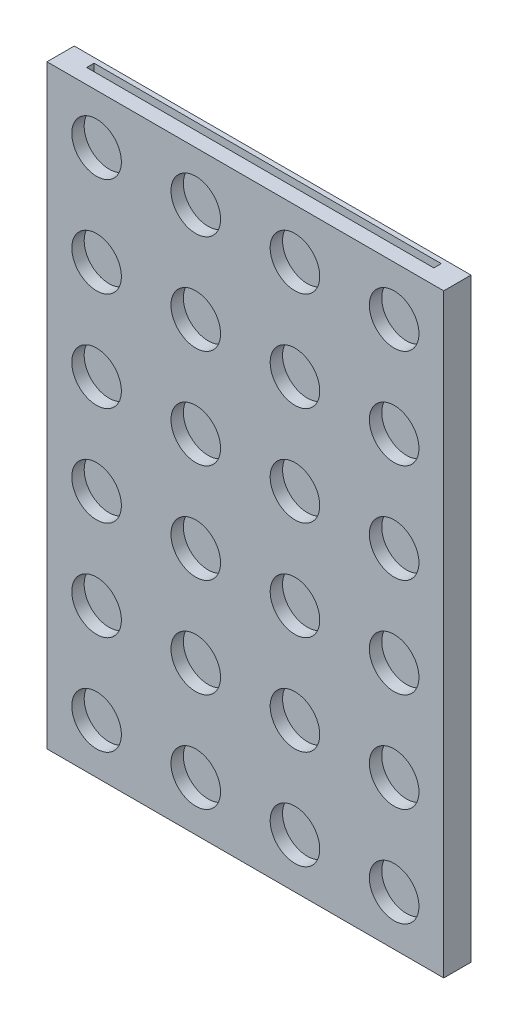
SolidWorks part; units mm, degrees
ref_plane "Front Plane" through (0, 0, 0) normal (0, 0, 1) x (1, 0, 0)
ref_plane "Top Plane" through (0, 0, 0) normal (0, 1, 0) x (1, 0, 0)
ref_plane "Right Plane" through (0, 0, 0) normal (1, 0, 0) x (0, 0, -1)
sketch "Sketch1" plane through (0, 0, 0) normal (0, 0, 1) x (1, 0, 0)
  line L1 (0, 0) -> (101.6, 0)
  line L2 (0, 0) -> (0, 152.4)
  line L3 (0, 152.4) -> (101.6, 152.4)
  line L4 (101.6, 0) -> (101.6, 152.4)
  dimension "D1" = 152.4
  dimension "D2" = 101.6
extrude "Boss-Extrude1" add sketch "Sketch1" along normal blind 6.985
sketch "Sketch3" plane through (0, 0, 6.985) normal (0, 0, 1) x (1, 0, 0)
  line L0 (0, 152.4) -> (0, 0) construction
  line L1 (101.6, 152.4) -> (0, 152.4) construction
  line L2 (0, 0) -> (101.6, 0) construction
  line L3 (25.4, 152.4) -> (25.4, 0)
  line L5 (12.7, 152.4) -> (12.7, 0)
  line L6 (38.1, 152.4) -> (38.1, 0)
  line L7 (50.8, 152.4) -> (50.8, 0)
  line L8 (63.5, 152.4) -> (63.5, 0)
  line L9 (76.2, 152.4) -> (76.2, 0)
  line L10 (88.9, 152.4) -> (88.9, 0)
  line L11 (0, 12.7) -> (101.6, 12.7)
  line L12 (101.6, 0) -> (101.6, 152.4) construction
  line L13 (0, 25.4) -> (101.6, 25.4)
  line L14 (0, 38.1) -> (101.6, 38.1)
  line L15 (0, 50.8) -> (101.6, 50.8)
  line L16 (0, 63.5) -> (101.6, 63.5)
  line L17 (0, 63.6141) -> (101.6, 63.6141)
  line L18 (0, 76.2) -> (101.6, 76.2)
  line L19 (0, 88.9) -> (101.6, 88.9)
  line L20 (0, 101.6) -> (101.6, 101.6)
  line L21 (0, 114.3) -> (101.6, 114.3)
  line L22 (0, 127) -> (101.6, 127)
  line L23 (0, 139.7) -> (101.6, 139.7)
  circle A0 centre (12.7, 139.7) radius 6.35
  circle A2 centre (38.1, 139.7) radius 6.35
  circle A4 centre (63.5, 139.7) radius 6.35
  circle A6 centre (88.9, 139.7) radius 6.35
  circle A7 centre (88.9, 114.3) radius 6.35
  circle A8 centre (63.5, 114.3) radius 6.35
  circle A9 centre (38.1, 114.3) radius 6.35
  circle A10 centre (12.7, 114.3) radius 6.35
  circle A11 centre (88.9, 88.9) radius 6.35
  circle A12 centre (63.5, 88.9) radius 6.35
  circle A13 centre (38.1, 88.9) radius 6.35
  circle A14 centre (12.7, 88.9) radius 6.35
  circle A15 centre (88.9, 63.5) radius 6.35
  circle A16 centre (63.5, 63.5) radius 6.35
  circle A17 centre (38.1, 63.5) radius 6.35
  circle A18 centre (12.7, 63.5) radius 6.35
  circle A19 centre (88.9, 38.1) radius 6.35
  circle A20 centre (63.5, 38.1) radius 6.35
  circle A21 centre (38.1, 38.1) radius 6.35
  circle A22 centre (12.7, 38.1) radius 6.35
  circle A23 centre (88.9, 12.7) radius 6.35
  circle A24 centre (63.5, 12.7) radius 6.35
  circle A25 centre (38.1, 12.7) radius 6.35
  circle A26 centre (12.7, 12.7) radius 6.35
  dimension "D1" = 12.7
  dimension "D2" = 12.7
  dimension "D3" = 12.7
  dimension "D4" = 12.7
  dimension "D5" = 12.7
  dimension "D6" = 12.7
  dimension "D7" = 12.7
  dimension "D8" = 12.7
  dimension "D9" = 12.7
  dimension "D10" = 12.7
  dimension "D11" = 12.7
  dimension "D12" = 12.7
  dimension "D13" = 12.7
  dimension "D14" = 12.7
  dimension "D15" = 12.7
  dimension "D16" = 12.7
  dimension "D17" = 12.7
  dimension "D18" = 12.7
extrude "Cut-Extrude2" cut sketch "Sketch3" against normal blind 3.175 contours A0 | A2 | A4 | A6 | A7 | A8 | A9 | A10 | A14 | A13 | A12 | A11 | A18 | A17 | A16 | A15 | A22 | A21 | A20 | A19 | A26 | A25 | A24 | A23
sketch "Sketch4" plane through (0, 0, 0) normal (0, 0, -1) x (-1, 0, 0)
  line L0 (-93.98, 144.78) -> (-93.98, 7.62)
  line L1 (-93.98, 7.62) -> (-7.62, 7.62)
  line L2 (-7.62, 7.62) -> (-7.62, 144.78)
  line L3 (-7.62, 144.78) -> (-93.98, 144.78)
  line L4 (-101.6, 0) -> (-101.6, 152.4) construction
  line L5 (0, 0) -> (-101.6, 0) construction
  line L6 (0, 152.4) -> (0, 0) construction
  line L7 (-101.6, 152.4) -> (0, 152.4) construction
  dimension "D1" = 7.62
  dimension "D2" = 7.62
  dimension "D3" = 7.62
  dimension "D4" = 7.62
sketch "Sketch5" plane through (0, 152.4, 0) normal (0, 1, 0) x (1, 0, 0)
  line L0 (6.35, -1.27) -> (95.25, -1.27)
  line L1 (95.25, -1.27) -> (95.25, -3.175)
  line L2 (95.25, -3.175) -> (6.35, -3.175)
  line L3 (6.35, -3.175) -> (6.35, -1.27)
  line L4 (0, -6.985) -> (0, 0) construction
  line L5 (101.6, -6.985) -> (101.6, 0) construction
  line L6 (101.6, 0) -> (0, 0) construction
  dimension "D1" = 6.35
  dimension "D2" = 6.35
  dimension "D3" = 1.905
  dimension "D4" = 1.27
extrude "Cut-Extrude3" cut sketch "Sketch5" against normal blind 146.05
extrude "Cut-Extrude4" cut sketch "Sketch4" against normal blind 2.54
